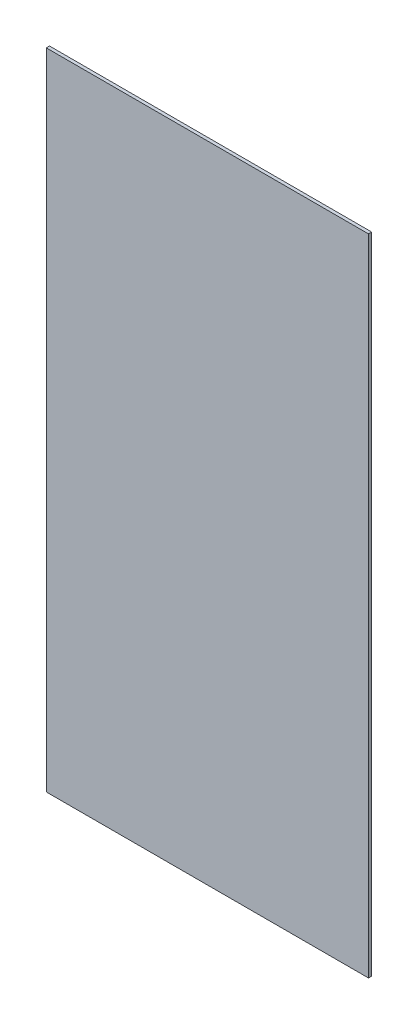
SolidWorks part; units mm, degrees
ref_plane "Plan de face" through (0, 0, 0) normal (0, 0, 1) x (1, 0, 0)
ref_plane "Plan de dessus" through (0, 0, 0) normal (0, 1, 0) x (1, 0, 0)
ref_plane "Plan de droite" through (0, 0, 0) normal (1, 0, 0) x (0, 0, -1)
sketch "Esquisse1" plane through (0, 0, 0) normal (0, 0, 1) x (1, 0, 0)
  line L0 (-345, 64.3213) -> (-345, 113.8213) construction
  line L1 (-845, 1366.5713) -> (155, 1366.5713)
  line L2 (-845, 1366.5713) -> (-845, -633.4287)
  line L3 (-845, -633.4287) -> (155, -633.4287)
  line L4 (155, 1366.5713) -> (155, -633.4287)
  line L5 (-570, -533.4287) -> (-120, -533.4287) construction
  dimension "D1" = 500
  dimension "D2" = 100
  dimension "D3" = 1000
  dimension "D4" = 2000
extrude "Boss.-Extru.1" add sketch "Esquisse1" along normal blind 10
